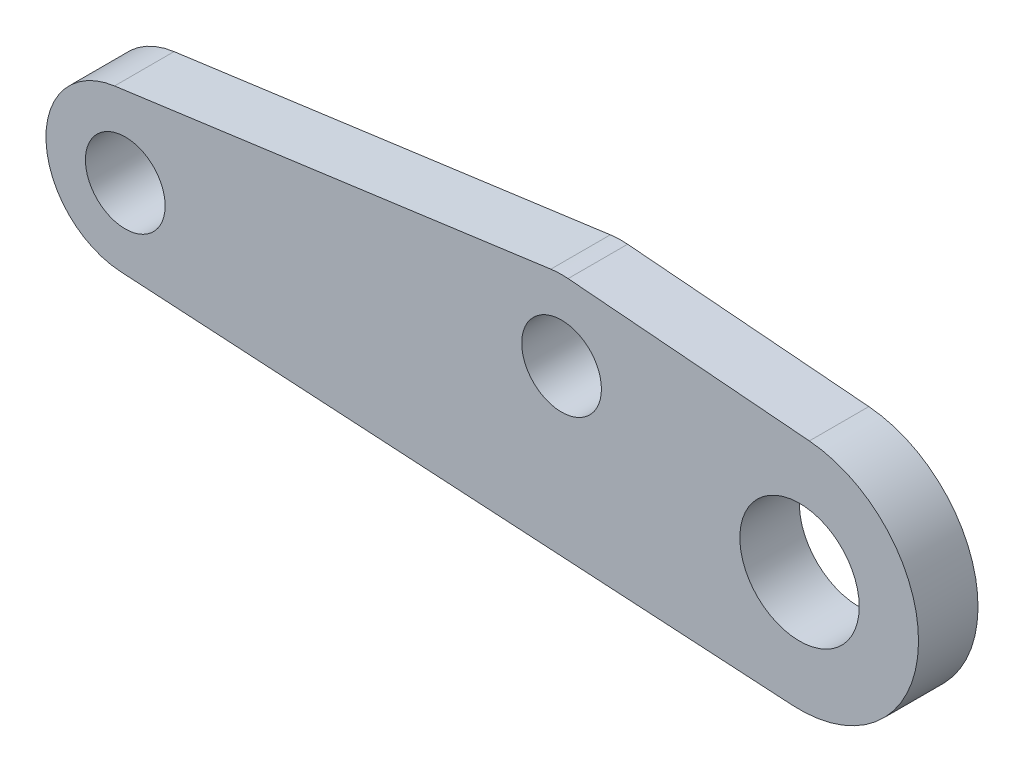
SolidWorks part; units mm, degrees
ref_plane "Face" through (0, 0, 0) normal (0, 0, 1) x (1, 0, 0)
ref_plane "Dessus" through (0, 0, 0) normal (0, 1, 0) x (1, 0, 0)
ref_plane "Droite" through (0, 0, 0) normal (1, 0, 0) x (0, 0, -1)
sketch "Esquisse1" plane through (0, 0, 0) normal (0, 0, 1) x (1, 0, 0)
  line L0 (0, 0) -> (170, 0) construction
  line L1 (110, 60.2118) -> (110, 25.05) construction
  line L2 (170, 33.299) -> (170, -33.299) construction
  line L3 (89.2205, 15) -> (136.9707, 15) construction
  line L4 (-1.1765, -19.9654) -> (168.2353, -29.9481)
  line L5 (-2.7023, 19.8166) -> (107.2977, 34.8166)
  line L6 (111.6496, 34.9319) -> (172.4744, 29.8978)
  line L7 (110, 15) -> (110, -15.89) construction
  circle A0 centre (0, 0) radius 10.05
  arc A1 (-2.7023, 19.8166) -> (-1.1765, -19.9654) centre (0, 0) ccw
  circle A2 centre (170, 0) radius 15.05
  arc A3 (168.2353, -29.9481) -> (172.4744, 29.8978) centre (170, 0) ccw
  circle A4 centre (110, 15) radius 10.05
  arc A5 (111.6496, 34.9319) -> (107.2977, 34.8166) centre (110, 15) ccw
  dimension "D1" = 40
  dimension "D2" = 20.1
  dimension "D6" = 20.1
  dimension "D7" = 60
  dimension "D8" = 30.1
  dimension "D9" = 40
  dimension "D3" = 110
  dimension "D4" = 170
  dimension "D5" = 15
extrude "Extrusion1" add sketch "Esquisse1" along normal blind 15
